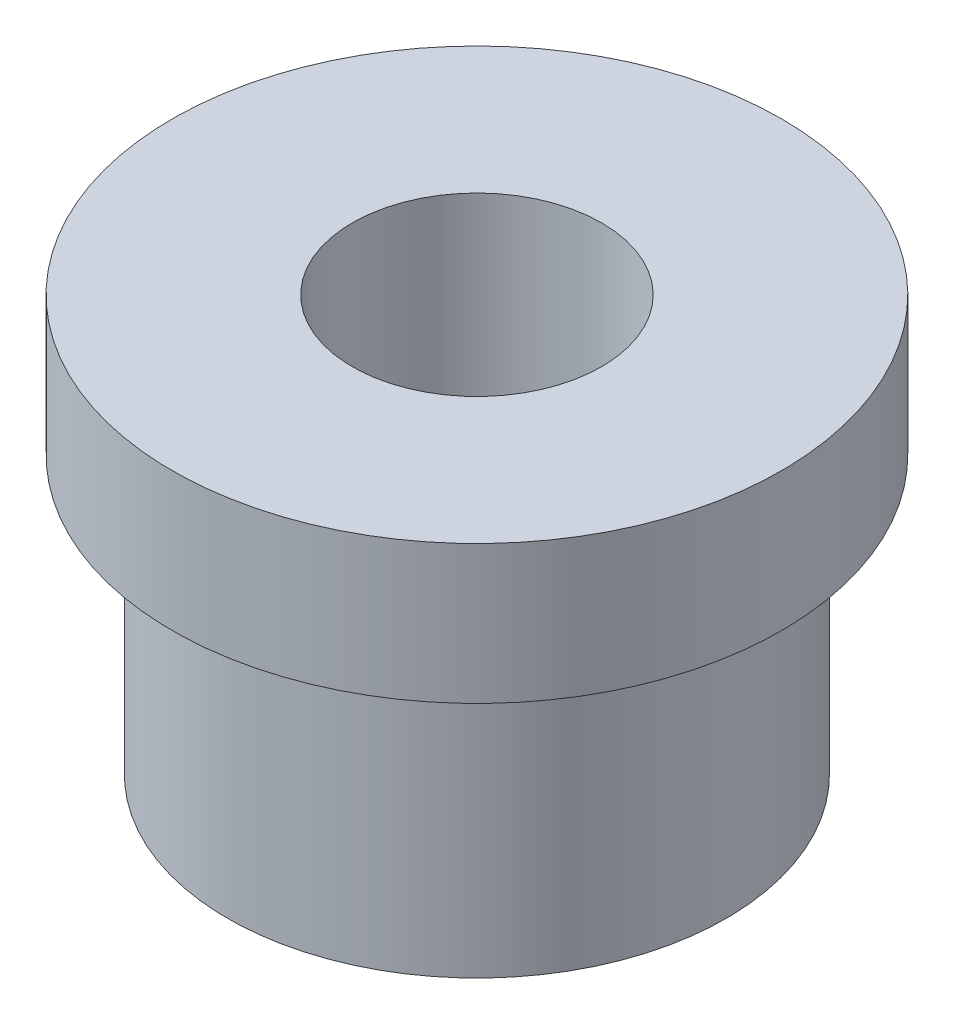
SolidWorks part; units mm, degrees
ref_plane "前视基准面" through (0, 0, 0) normal (0, 0, 1) x (1, 0, 0)
ref_plane "上视基准面" through (0, 0, 0) normal (0, 1, 0) x (1, 0, 0)
ref_plane "右视基准面" through (0, 0, 0) normal (1, 0, 0) x (0, 0, -1)
sketch "草图1" plane through (0, 0, 0) normal (0, 0, 1) x (1, 0, 0)
  line L0 (0, -3) -> (0, 18) construction
  line L1 (4.5, 0) -> (9, 0)
  line L2 (9, 0) -> (9, 10)
  line L3 (9, 10) -> (11, 10)
  line L4 (11, 10) -> (11, 15)
  line L5 (11, 15) -> (4.5, 15)
  line L6 (4.5, 15) -> (4.5, 0)
  dimension "D1" = 4.5
  dimension "D2" = 4.5
  dimension "D3" = 6.5
  dimension "D4" = 5
  dimension "D5" = 15
revolve "旋转1" add sketch "草图1" angle 360 about L0
